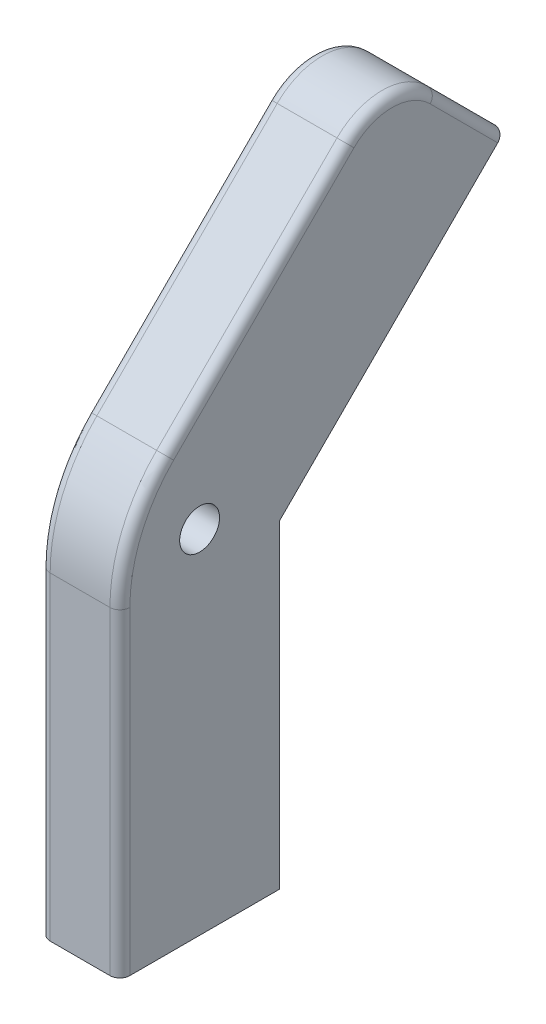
SolidWorks part; units mm, degrees
ref_plane "Front Plane" through (0, 0, 0) normal (0, 0, 1) x (1, 0, 0)
ref_plane "Top Plane" through (0, 0, 0) normal (0, 1, 0) x (1, 0, 0)
ref_plane "Right Plane" through (0, 0, 0) normal (1, 0, 0) x (0, 0, -1)
sketch "Sketch1" plane through (0, 0, 0) normal (1, 0, 0) x (0, 0, -1)
  line L0 (6.35, 0) -> (15.3303, 8.9803)
  line L2 (0, 0) -> (0, -12.7)
  line L3 (0, -12.7) -> (6.35, -12.7)
  line L4 (6.35, 0) -> (6.35, -12.7)
  line L6 (15.3303, 8.9803) -> (10.8401, 13.4704)
  line L8 (10.8401, 13.4704) -> (1.8599, 4.4901)
  arc A0 (0, 0) -> (1.8599, 4.4901) centre (6.35, 0) cw
  dimension "D1" = 6.35
  dimension "D2" = 12.7
  dimension "D3" = 6.35
  dimension "D4" = 12.7
extrude "Extrude1" add sketch "Sketch1" along direction (1, 0, 0) on the side of the normal blind 3.175
sketch "Sketch2" plane through (3.175, 0, 0) normal (1, 0, 0) x (0, 0, -1)
  line L0 (3.175, -12.7) -> (3.175, 13.2294) construction
  line L1 (0, -12.7) -> (6.35, -12.7) construction
  line L2 (13.0852, 11.2253) -> (-8.2548, -10.1147) construction
  line L3 (15.3303, 8.9803) -> (10.8401, 13.4704) construction
  circle A0 centre (3.175, 1.3151) radius 0.7938
  point P8 (3.175, 1.3151)
extrude "Extrude2" cut sketch "Sketch2" against normal through all
fillet "Fillet2" radius 2.54 1 edges at (1.5875, 13.4704, -10.8401)
fillet "Fillet3" radius 0.3969 10 edges at (0, -6.35, 0) (0, 2.43, -0.4834) (0, 8.0822, -5.452) (0, 10.3273, -13.9832) (3.175, 10.3273, -13.9832) (3.175, -6.35, 0) (3.175, 2.43, -0.4834) (3.175, 8.0822, -5.452) (0, 12.4183, -10.8401) (3.175, 12.4183, -10.8401)
